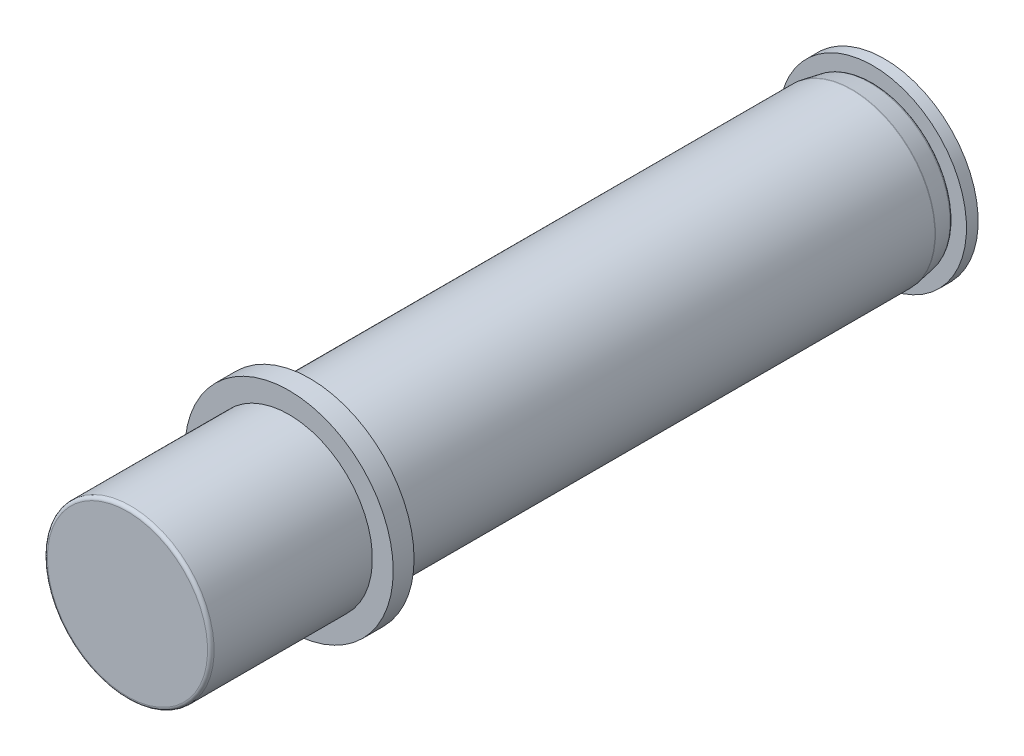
SolidWorks part; units mm, degrees
ref_plane "Front" through (0, 0, 0) normal (0, 0, 1) x (1, 0, 0)
ref_plane "Top" through (0, 0, 0) normal (0, 1, 0) x (1, 0, 0)
ref_plane "Right" through (0, 0, 0) normal (1, 0, 0) x (0, 0, -1)
sketch "Logo3_Revol_Axis" plane through (0, 0, 0) normal (0, 1, 0) x (1, 0, 0)
  line L0 (0, -30.1653) -> (0, 30.1653) construction
sketch "Logo3_bib1" plane through (0, 0, 0) normal (0, -1, 0) x (-1, 0, 0)
  line L0 (0, 177.8) -> (23.4412, 177.8)
  line L1 (24.426, 176.9736) -> (25.3848, 171.5362)
  line L2 (25.4, 171.3625) -> (25.4, 6.35)
  line L3 (25.4, 6.35) -> (31.75, 6.35)
  line L4 (31.75, 6.35) -> (31.75, 0)
  line L5 (31.75, 0) -> (25.4, 0)
  line L6 (25.4, 0) -> (25.4, -48.2125)
  line L7 (24.4, -49.2125) -> (0, -49.2125)
  line L8 (0, 177.8) -> (0, -49.2125)
  line L10 (0, 41.5372) -> (0, -40.1764) construction
  arc A0 (23.4412, 177.8) -> (24.426, 176.9736) centre (23.4412, 176.8) cw
  arc A1 (25.3848, 171.5362) -> (25.4, 171.3625) centre (24.4, 171.3625) cw
  arc A2 (25.4, -48.2125) -> (24.4, -49.2125) centre (24.4, -48.2125) cw
  point P15 (25.4, 171.45)
  dimension "D5" = 1
  dimension "logo3_d1" = 50.8
  dimension "logo3_l1" = 177.8
  dimension "logo3_AngCone" = 10
  dimension "logo3_l2" = 49.2125
  dimension "logo3_HCone" = 6.35
  dimension "logo3_l4" = 6.35
  dimension "logo3_d2" = 63.5
revolve "Revolve1" add sketch "Logo3_bib1" angle 360 about L10
sketch "Logo3_bib2" [suppressed] plane through (0, 0, -177.8) normal (0, 0, -1) x (-1, 0, 0)
  circle A0 centre (0, 0) radius 28.575
  dimension "logo3_WashDia" = 57.15
extrude "Extrude1" [suppressed] add sketch "Logo3_bib2" along normal blind 3.556
sketch "Logo3_bib3" [suppressed] plane through (0, 0, -181.356) normal (0, 0, -1) x (-1, 0, 0)
  line L1 (-8.2489, 0) -> (-4.1244, -7.1437)
  line L2 (-4.1244, -7.1437) -> (4.1244, -7.1438)
  line L3 (4.1244, -7.1438) -> (8.2489, 0)
  line L4 (8.2489, 0) -> (4.1244, 7.1437)
  line L5 (4.1244, 7.1437) -> (-4.1244, 7.1437)
  line L6 (-4.1244, 7.1437) -> (-8.2489, 0)
  circle A0 centre (0, 0) radius 7.1438 construction
  dimension "logo3_ScrewHeadDia" = 14.2875
extrude "Extrude2" [suppressed] add sketch "Logo3_bib3" along normal blind 5.969
sketch "Logo3_bib4" [suppressed] plane through (0, 0, 0) normal (0, 1, 0) x (1, 0, 0)
  line L0 (8.2489, 187.325) -> (8.2489, 181.356) construction
  line L1 (-4.1244, 187.325) -> (4.1244, 187.325) construction
  line L2 (8.2489, 186.2199) -> (8.2489, 187.325)
  line L3 (8.2489, 187.325) -> (7.1437, 187.325)
  line L4 (0, 0) -> (0, 95.3858) construction
  arc A0 (8.2489, 186.2199) -> (7.1437, 187.325) centre (7.1437, 186.2199) ccw
  dimension "logo3_ScrewHeadDia/2" = 7.1437
revolve "Cut-Revolve1" [suppressed] cut sketch "Logo3_bib4" angle 360 about L4
sketch "Logo3_bib5" [suppressed] plane through (0, 0, -83) normal (0, 0, -1) x (-1, 0, 0)
  circle A0 centre (0, 0) radius 6
  circle A1 centre (0, 0) radius 11
  circle A2 centre (0, 0) radius 11
  dimension "logo3_WashDia*2/3" = 12
  dimension "D1" = 0
extrude "Extrude3" [suppressed] cut sketch "Logo3_bib5" against normal blind 2
